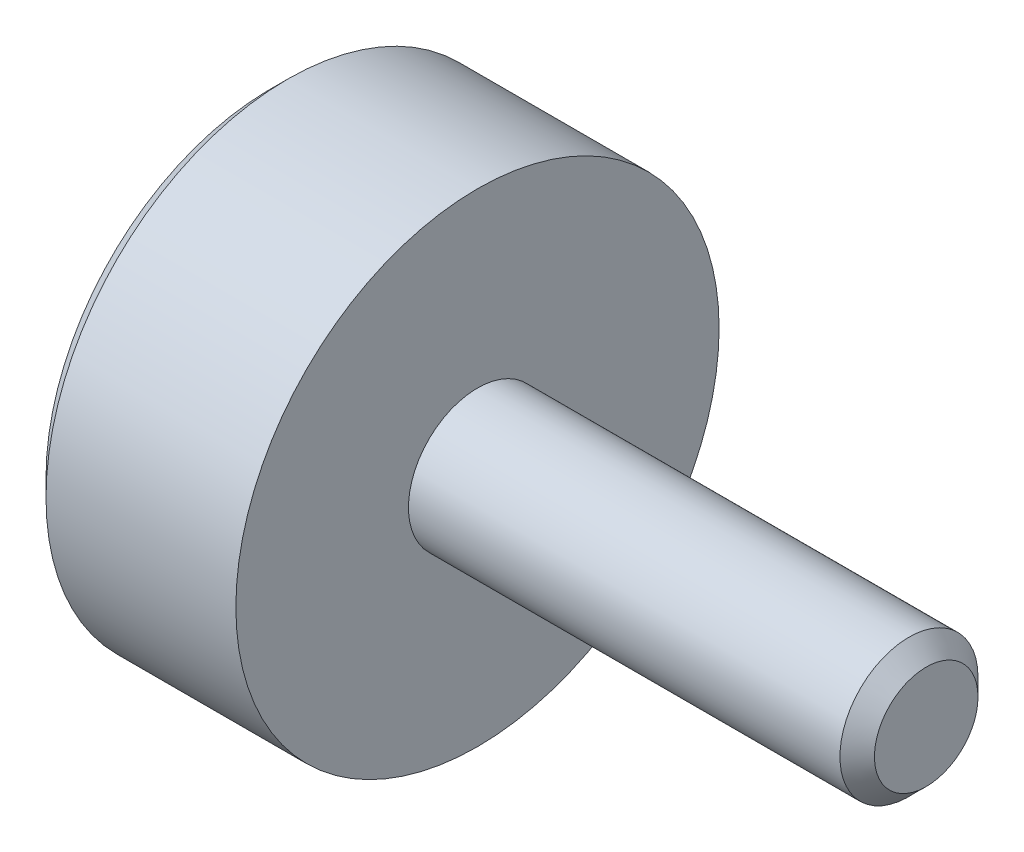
SolidWorks part; units mm, degrees
ref_plane "Front Plane" through (0, 0, 0) normal (0, 0, 1) x (1, 0, 0)
ref_plane "Top Plane" through (0, 0, 0) normal (0, 1, 0) x (1, 0, 0)
ref_plane "Right Plane" through (0, 0, 0) normal (1, 0, 0) x (0, 0, -1)
sketch "Sketch1" plane through (0, 0, 0) normal (0, 0, 1) x (1, 0, 0)
  line L0 (0, 0) -> (-97.7801, 0) construction
  line L1 (22.225, 6.35) -> (-19.05, 6.35)
  line L2 (62.6745, 6.35) -> (-18.2245, 6.35) construction
  line L3 (-19.05, 29.5275) -> (-19.05, -29.5275) construction
  line L4 (-19.05, 6.35) -> (-19.05, 22.225)
  line L5 (22.225, 6.35) -> (22.225, 0)
  line L6 (22.225, 0) -> (-38.1, 0)
  line L7 (-38.1, 86.5378) -> (-38.1, -86.5378) construction
  line L8 (-19.05, 22.225) -> (-38.1, 22.225)
  line L9 (-38.1, 22.225) -> (-38.1, 0)
  dimension "D1" = 22.225
revolve "Revolve1" add sketch "Sketch1" angle 360 about L0
chamfer "Chamfer1" distance 1.5875 angle 45 2 edges at (22.225, 0, -6.35) (-38.1, 0, -22.225)
sketch "Sketch2" plane through (-38.1, 0, 0) normal (-1, 0, 0) x (0, 0, 1)
  line L1 (14.6647, 0) -> (7.3323, 12.7)
  line L2 (7.3323, 12.7) -> (-7.3323, 12.7)
  line L3 (-7.3323, 12.7) -> (-14.6647, 0)
  line L4 (-14.6647, 0) -> (-7.3323, -12.7)
  line L5 (-7.3323, -12.7) -> (7.3323, -12.7)
  line L6 (7.3323, -12.7) -> (14.6647, 0)
  circle A0 centre (0, 0) radius 12.7 construction
  dimension "D1" = 25.4
extrude "Cut-Extrude1" cut sketch "Sketch2" against normal blind 12.7
